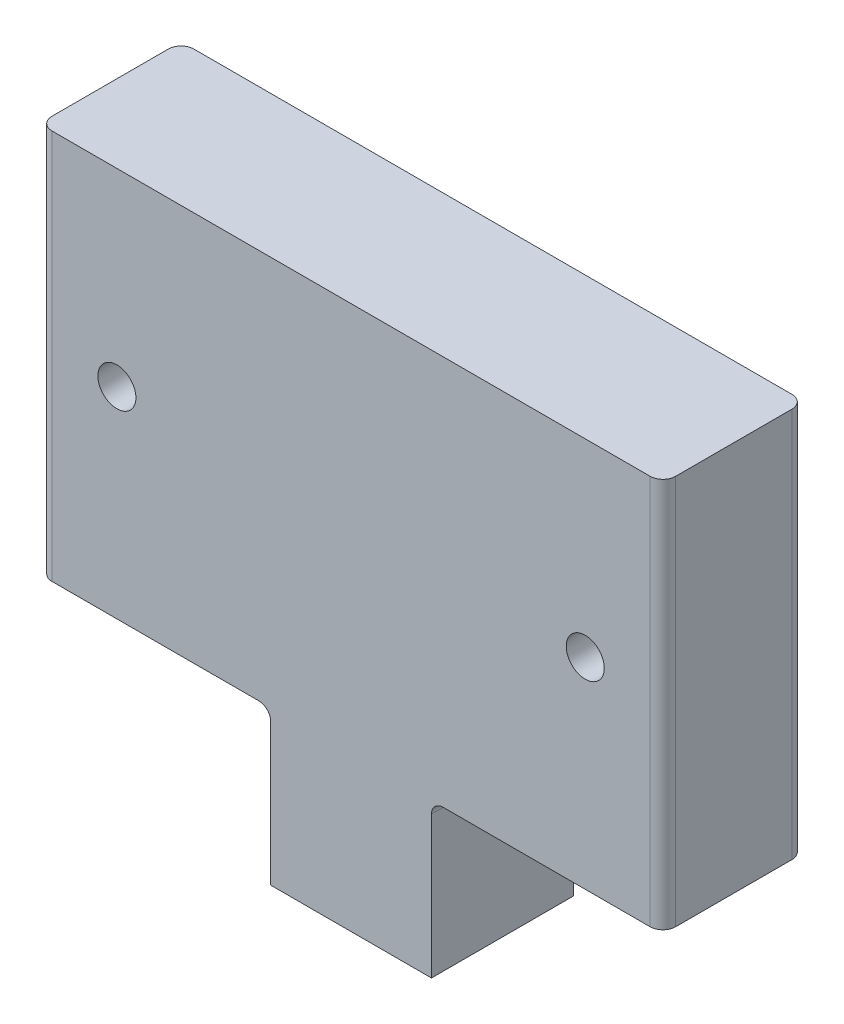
SolidWorks part; units mm, degrees
ref_plane "Front Plane" through (0, 0, 0) normal (0, 0, 1) x (1, 0, 0)
ref_plane "Top Plane" through (0, 0, 0) normal (0, 1, 0) x (1, 0, 0)
ref_plane "Right Plane" through (0, 0, 0) normal (1, 0, 0) x (0, 0, -1)
sketch "Sketch1" plane through (0, 0, 0) normal (0, 0, 1) x (1, 0, 0)
  line L0 (41.9989, -26.1938) -> (41.9989, 23.0187) construction
  line L1 (-41.8719, 26.1937) -> (41.8719, 26.1937)
  line L2 (-41.8719, 26.1937) -> (-41.8719, -26.1937)
  line L3 (-41.8719, -26.1937) -> (41.8719, -26.1937)
  line L4 (41.8719, 26.1937) -> (41.8719, -26.1937)
  line L5 (-41.8719, 26.1937) -> (41.8719, -26.1937) construction
  line L6 (-41.8719, -26.1937) -> (41.8719, 26.1937) construction
  point P0 (0, 0)
  dimension "D1" = 52.3875
  dimension "D2" = 0.127
extrude "Boss-Extrude1" add sketch "Sketch1" along normal mid plane 19.05
hole_wizard "1/4-20 Tapped Hole1" positions "Sketch4" profile "Sketch5" tap size "1/4-20" standard "ANSI Inch"
sketch "Sketch4" plane through (0, 0, 9.525) normal (0, 0, 1) x (1, 0, 0)
  line L0 (0, 26.1938) -> (0, 35.7719) construction
  line L1 (41.8719, 26.1937) -> (-41.8719, 26.1937) construction
  point P0 (-31.4452, 0.7937)
  point P10 (31.4452, 0.7937)
sketch "Sketch5" plane through (-31.4452, 0.7937, 9.525) normal (1, 0, 0) x (0, -1, 0)
  line L0 (0, 0) -> (0, 19.05)
  line L1 (0, 19.05) -> (2.5527, 19.05)
  line L2 (2.5527, 19.05) -> (2.5527, 0)
  line L5 (2.5527, 0) -> (0, 0)
  line L11 (0, -6.35) -> (0, 107.95) construction
  dimension "Thru Tap Drill Dia." = 5.1054
  dimension "Thru Tap Drill Depth" = 19.05
sketch "Sketch6" plane through (0, 0, 9.525) normal (0, 0, 1) x (1, 0, 0)
  line L0 (-41.8719, -26.1937) -> (41.8719, -26.1937) construction
  line L1 (-10.795, -26.1937) -> (10.795, -26.1937)
  line L2 (-10.795, -26.1937) -> (-10.795, -46.8312)
  line L3 (-10.795, -46.8312) -> (10.795, -46.8312)
  line L4 (10.795, -26.1937) -> (10.795, -46.8312)
  line L8 (-41.8719, 26.1937) -> (-41.8719, -26.1937) construction
  line L9 (0, -46.8312) -> (0, 26.1938) construction
  line L10 (41.8719, 26.1937) -> (-41.8719, 26.1937) construction
  dimension "D1" = 31.0769
  dimension "D2" = 20.6375
extrude "Boss-Extrude2" add sketch "Sketch6" against normal up to surface (19.05 mm away)
fillet "Fillet1" radius 1.7145 4 edges at (-41.8719, 0, -9.525) (-41.8719, 0, 9.525) (41.8719, 0, -9.525) (41.8719, 0, 9.525)
fillet "Fillet2" radius 1.5875 2 edges at (-10.795, -26.1937, 0) (10.795, -26.1937, 0)
